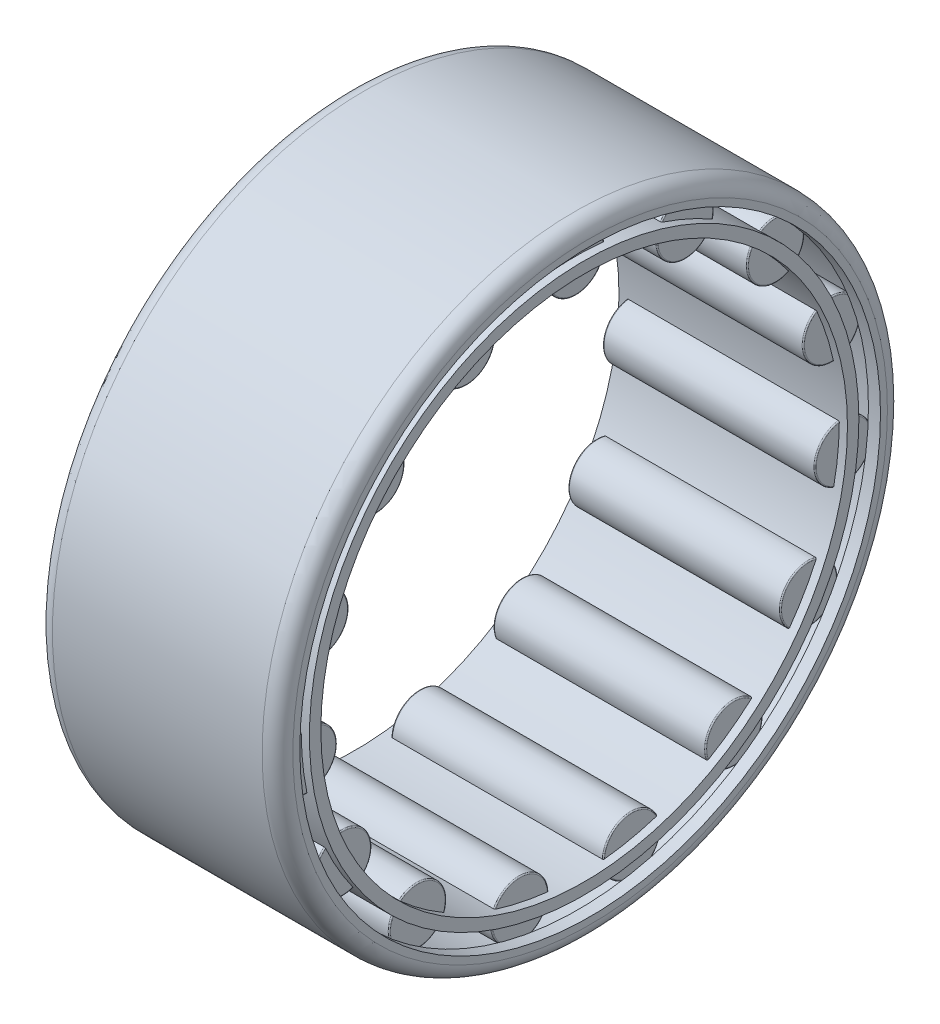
SolidWorks part; units mm, degrees
ref_plane "Plane1" through (0, 0, 0) normal (0, 0, 1) x (1, 0, 0)
ref_plane "Plane2" through (0, 0, 0) normal (0, 1, 0) x (1, 0, 0)
ref_plane "Plane3" through (0, 0, 0) normal (1, 0, 0) x (0, 0, -1)
other "Configuration Table"
sketch "Clipboard" plane through (0, 0, 0) normal (0, 0, 1) x (1, 0, 0)
  line L0 (-10, 0) -> (10, 0) construction
  line L1 (41.1529, 1.4371) -> (62.7517, -4.3503)
  line L2 (41.1529, 1.4371) -> (75.4583, 10.6292)
  line L3 (41.1529, 1.4371) -> (62.7517, -4.3503)
  line L4 (41.1529, 1.4371) -> (-22.3471, -0.7804)
sketch "InnRacSke" plane through (0, 0, 0) normal (0, 0, 1) x (1, 0, 0)
  line L0 (-14.2875, 38.3286) -> (-15.875, 38.3286)
  line L1 (-15.875, 38.3286) -> (-15.875, 39.243)
  line L2 (-13.843, 41.275) -> (13.843, 41.275)
  line L4 (15.875, 39.243) -> (15.875, 38.3286)
  line L5 (15.875, 38.3286) -> (14.2875, 38.3286)
  line L6 (14.2875, 38.3286) -> (14.2875, 39.2811)
  line L7 (14.2875, 39.2811) -> (-14.2875, 39.2811)
  line L8 (-14.2875, 39.2811) -> (-14.2875, 38.3286)
  line L9 (-31.75, 0) -> (31.75, 0) construction
  arc A0 (-15.875, 39.243) -> (-13.843, 41.275) centre (-13.843, 39.243) cw
  arc A2 (13.843, 41.275) -> (15.875, 39.243) centre (13.843, 39.243) cw
revolve "Race" add sketch "InnRacSke" angle 360 about L9
sketch "RolDetSke" plane through (0, 0, 0) normal (0, 0, 1) x (1, 0, 0)
  line L0 (-14.0018, 39.131) -> (-14.0017, 35.5155)
  line L1 (-14.0017, 35.5155) -> (14.0017, 35.5155)
  line L2 (14.0017, 35.5155) -> (14.0018, 39.131)
  line L3 (13.8511, 39.2816) -> (-13.8511, 39.2816)
  line L4 (-28.575, 35.5155) -> (28.575, 35.5155) construction
  arc A0 (14.0018, 39.131) -> (13.8511, 39.2816) centre (13.8511, 39.131) ccw
  arc A1 (-13.8511, 39.2816) -> (-14.0018, 39.131) centre (-13.8511, 39.131) ccw
revolve "RollerDetailed" add sketch "RolDetSke" angle 360 about L4
ref_axis "Axis1" through (-50, 0, 0) along (1, 0, 0)
sketch "CagSpiSke" plane through (0, 0, 0) normal (0, 0, 1) x (1, 0, 0)
  line L0 (15.0812, 34.7623) -> (15.0812, 36.2688)
  line L1 (15.0812, 36.2688) -> (-15.0813, 36.2688)
  line L2 (-15.0813, 36.2688) -> (-15.0813, 34.7623)
  line L3 (-15.0813, 34.7623) -> (15.0812, 34.7623)
  line L4 (-31.75, 0) -> (31.75, 0) construction
revolve "CageSpine" add sketch "CagSpiSke" angle 360 about L4
pattern_circular "RollersDetailed" count 15 every 24 about axis through (-50, 0, 0) along (1, 0, 0) of "RollerDetailed"
sketch "RolSimSke" plane through (0, 0, 0) normal (0, 0, 1) x (1, 0, 0)
  line L0 (-25.4, 0) -> (25.4, 0) construction
  line L2 (-13.8511, 39.2821) -> (13.8511, 39.2821)
  line L3 (-14.0018, 39.1315) -> (-14.0018, 31.9006)
  line L4 (-13.8511, 31.75) -> (13.8511, 31.75)
  line L5 (14.0017, 39.1315) -> (14.0017, 31.9006)
  arc A0 (-14.0018, 31.9006) -> (-13.8511, 31.75) centre (-13.8511, 31.9006) ccw
  arc A1 (-13.8511, 39.2821) -> (-14.0018, 39.1315) centre (-13.8511, 39.1315) ccw
  arc A2 (14.0017, 39.1315) -> (13.8511, 39.2821) centre (13.8511, 39.1315) ccw
  arc A3 (13.8511, 31.75) -> (14.0017, 31.9006) centre (13.8511, 31.9006) ccw
  point P10 (-14.0018, 31.75)
  point P15 (14.0017, 39.2821)
  point P18 (14.0017, 31.75)
revolve "RollersSimplified" [suppressed] add sketch "RolSimSke" angle 360 about L0
equation "\"BallCLRad@Clipboard\" =  ( \"D1@InnRacSke\" + \"Bore@Clipboard\" )  / 4"
equation "\"RollerCLRad@RolDetSke\" = \"BallCLRad@Clipboard\""
equation "\"halfCyl@InnRacSke\" = \"Cyl_Len@InnRacSke\" / 2"
equation "\"Roller_diameter@RolDetSke\" =  ( \"D1@InnRacSke\" - \"Bore@Clipboard\" )  / 2 + .001"
equation "\"Roller_radius@RolDetSke\" = \"Roller_diameter@RolDetSke\" / 50"
equation "\"Roller_length@RolDetSke\" = \"Cyl_Len@InnRacSke\" * .98"
equation "\"halfLength@RolDetSke\" = \"Roller_length@RolDetSke\" / 2"
equation "\"Cage_width@CagSpiSke\" =  ( \"Cyl_Len@InnRacSke\" + \"Width@InnRacSke\" )  / 2"
equation "\"halfWidth@CagSpiSke\" = \"Cage_width@CagSpiSke\" / 2"
equation "\"Cage_thickness@CagSpiSke\"  = \"Roller_diameter@RolDetSke\" / 5"
equation "\"D2@CagSpiSke\" =  \"RollerCLRad@RolDetSke\" * 2 - \"Cage_thickness@CagSpiSke\""
equation "\"Roller_length@RolSimSke\" = \"Cyl_Len@InnRacSke\" * .98"
equation "\"halfWidth@RolSimSke\" = \"Roller_length@RolSimSke\" / 2"
equation "\"D1@RolSimSke\" = \"Roller_radius@RolDetSke\""
equation "\"Roller_diameter@RolSimSke\" =  ( \"D1@InnRacSke\" - \"Bore@Clipboard\" )  / 2 + .001"
equation "\"Max_count@Clipboard\" = int( 3.14159265 / atn(( \"Roller_diameter@RolDetSke\" / 2) / sqr( \"RollerCLRad@RolDetSke\"  *  \"RollerCLRad@RolDetSke\" - ( \"Roller_diameter@RolDetSke\" / 2) *  ( \"Roller_diameter@R"
equation "\"Max_count@Clipboard\" = ((sgn( \"Max_count@Clipboard\" - \"Count@Clipboard\" )-1)*( \"Max_count@Clipboard\" - \"Count@Clipboard\" ))/-2+ \"Count@Clipboard\""
equation "\"Count@RollersDetailed\" = int( \"Show_count@Clipboard\" ) "
equation "\"Count@RollersDetailed\" = ((sgn( \"Count@RollersDetailed\" - \"Max_count@Clipboard\" )-1)*( \"Count@RollersDetailed\" - \"Max_count@Clipboard\" ))/-2+ \"Max_count@Clipboard\""
equation "\"Count@RollersDetailed\" = ((sgn( \"Count@RollersDetailed\" - \"Min_count@Clipboard\" )+1)*( \"Count@RollersDetailed\" - \"Min_count@Clipboard\"))/2 +\"Min_count@Clipboard\""
equation "\"Angle@RollersDetailed\" = 360.0 / \"Max_count@Clipboard\""
equation "\"Angle@CageSpine\" =  \"Angle@RollersDetailed\" * ( \"Count@RollersDetailed\" -1 + int( \"Count@RollersDetailed\" / \"Max_count@Clipboard\" ) )  + 0.001 -  int( \"Count@RollersDetailed\" / \"Max_count@Clipboard\" "
equation "\"Angle@CageSpine\" =  \"Angle@CageSpine\" * int( \"Min_count@Clipboard\" / 2) + int(1 / \"Min_count@Clipboard\")  * 0.001"
equation "\"Bore@RolSimSke\" = \"Bore@Clipboard\""
